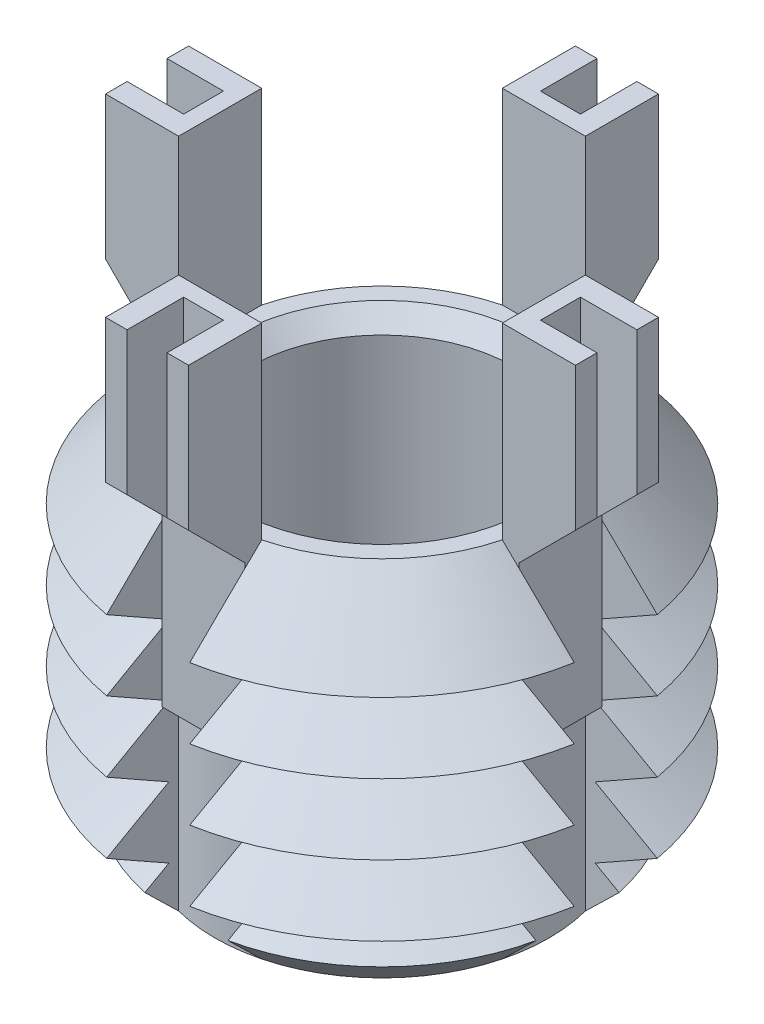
SolidWorks part; units mm, degrees
ref_plane "Front Plane" through (0, 0, 0) normal (0, 0, 1) x (1, 0, 0)
ref_plane "Top Plane" through (0, 0, 0) normal (0, 1, 0) x (1, 0, 0)
ref_plane "Right Plane" through (0, 0, 0) normal (1, 0, 0) x (0, 0, -1)
sketch "Sketch1" plane through (0, 0, 0) normal (0, 1, 0) x (1, 0, 0)
  circle A0 centre (0, 0) radius 7.144
  dimension "D1" = 14.288
extrude "Boss-Extrude1" add sketch "Sketch1" against normal blind 10.922
chamfer "Chamfer1" distance 2.117 angle 45 2 edges at (0, -10.922, 7.144) (0, 0, 7.144)
sketch "Sketch2" plane through (0, 0, 0) normal (1, 0, 0) x (0, 0, -1)
  line L0 (0, 0.8859) -> (0, -9.2617) construction
sketch "Sketch3" plane through (0, 0, 0) normal (1, 0, 0) x (0, 0, -1)
  line L0 (-7.144, -2.117) -> (-5.3106, -3.1755)
  line L1 (-5.3106, -3.1755) -> (-7.144, -4.234)
  line L2 (-7.144, -2.117) -> (-7.144, -8.805) construction
  line L3 (-7.144, -4.234) -> (-7.144, -2.117)
  dimension "D1" = 2.117
revolve "Cut-Revolve1" cut sketch "Sketch3" angle 360 about L0
pattern_linear "LPattern1" count 4 spacing 2.117 along (0, -1, 0) of "Cut-Revolve1"
sketch "Sketch4" plane through (0, 0, 0) normal (0, 1, 0) x (1, 0, 0)
  line L0 (-4.8691, 1.25) -> (-7.0338, 1.25)
  line L2 (-7.0338, -1.25) -> (-4.8691, -1.25)
  arc A0 (-4.8691, 1.25) -> (-4.8691, -1.25) centre (0, 0) ccw
  arc A1 (-7.0338, 1.25) -> (-7.0338, -1.25) centre (0, 0) ccw
  circle A2 centre (0, 0) radius 7.144 construction
  circle A3 centre (0, 0) radius 5.027 construction
  point P1 (-5.027, 0)
  point P3 (-7.144, 0)
  point P13 (0, 0)
  dimension "D1" = 2.5
extrude "Cut-Extrude1" cut sketch "Sketch4" against normal up to surface (10.922 mm away)
pattern_circular "CirPattern1" count 4 over 360 about axis through (0, 0, 0) along (0, 1, 0) of "Cut-Extrude1"
sketch "Sketch5" plane through (0, 0, 0) normal (1, 0, 0) x (0, 0, -1)
  line L0 (-4.8691, 5.649) -> (-4.8691, -5.351)
  line L1 (-4.8691, -5.351) -> (-5.3691, -5.351)
  line L2 (-5.3691, -5.351) -> (-5.3691, -0.351)
  line L3 (-5.3691, -0.351) -> (-7.0691, 1.349)
  line L4 (-7.0691, 1.349) -> (-7.0691, 5.649)
  line L5 (-7.0691, 5.649) -> (-4.8691, 5.649)
  line L6 (-7.0338, -6.351) -> (-1.25, -6.351) construction
  point P9 (-1.25, 0)
  point P10 (-5.3691, -0.351)
  dimension "D1" = 1
  dimension "D2" = 11
  dimension "D3" = 6
  dimension "D4" = 2.2
  dimension "D5" = 0.5
  dimension "D6" = 45
extrude "Boss-Extrude3" add sketch "Sketch5" along normal mid plane 2.5
pattern_circular "CirPattern2" count 4 over 360 about axis through (0, 0, 0) along (0, 1, 0) of "Boss-Extrude3"
sketch "Sketch6" plane through (0, 5.649, 0) normal (0, 1, 0) x (1, 0, 0)
  line L0 (-7.0691, -1.25) -> (-7.0691, 1.25) construction
  line L1 (-7.0691, -0.6) -> (-5.3691, -0.6)
  line L2 (-7.0691, -0.6) -> (-7.0691, 0.6)
  line L3 (-7.0691, 0.6) -> (-5.3691, 0.6)
  line L4 (-5.3691, -0.6) -> (-5.3691, 0.6)
  line L5 (-7.0691, -0.6) -> (-5.3691, 0.6) construction
  line L6 (-7.0691, 0.6) -> (-5.3691, -0.6) construction
  line L7 (7.0691, 1.25) -> (7.0691, -1.25) construction
  line L8 (-0.6, 5.3691) -> (0.6, 5.3691)
  line L9 (-0.6, 5.3691) -> (-0.6, 7.0691)
  line L10 (-0.6, 7.0691) -> (0.6, 7.0691)
  line L11 (0.6, 5.3691) -> (0.6, 7.0691)
  line L12 (-0.6, 5.3691) -> (0.6, 7.0691) construction
  line L13 (-0.6, 7.0691) -> (0.6, 5.3691) construction
  line L14 (5.3691, -0.6) -> (7.0691, -0.6)
  line L15 (5.3691, -0.6) -> (5.3691, 0.6)
  line L16 (5.3691, 0.6) -> (7.0691, 0.6)
  line L17 (7.0691, -0.6) -> (7.0691, 0.6)
  line L18 (5.3691, -0.6) -> (7.0691, 0.6) construction
  line L19 (5.3691, 0.6) -> (7.0691, -0.6) construction
  line L20 (-0.6, -7.0691) -> (0.6, -7.0691)
  line L21 (-0.6, -7.0691) -> (-0.6, -5.3691)
  line L22 (-0.6, -5.3691) -> (0.6, -5.3691)
  line L23 (0.6, -7.0691) -> (0.6, -5.3691)
  line L24 (-0.6, -7.0691) -> (0.6, -5.3691) construction
  line L25 (-0.6, -5.3691) -> (0.6, -7.0691) construction
  line L26 (-1.25, 7.0691) -> (1.25, 7.0691) construction
  line L27 (1.25, -7.0691) -> (-1.25, -7.0691) construction
  point P0 (-6.2191, 0)
  point P7 (-7.0691, 0)
  point P8 (-7.0691, 0)
  point P9 (0, 6.2191)
  point P14 (6.2191, 0)
  point P19 (0, -6.2191)
  point P24 (0, 7.0691)
  point P25 (7.0691, 0)
  point P26 (7.0691, 0)
  point P27 (0, 7.0691)
  point P30 (0, -7.0691)
  point P33 (0, -7.0691)
  dimension "D1" = 1.2
  dimension "D2" = 1.7
extrude "Cut-Extrude3" cut sketch "Sketch6" against normal through all both and the other way through all
sketch "Sketch7" plane through (0, 0, 0) normal (0, 1, 0) x (1, 0, 0)
  circle A0 centre (0, 0) radius 3.969
  dimension "D1" = 7.938
extrude "Cut-Extrude4" cut sketch "Sketch7" against normal up to surface (10.922 mm away)
chamfer "Chamfer2" distance 0.529 angle 45 2 edges at (0, 0, 3.969) (0, -10.922, 3.969)
